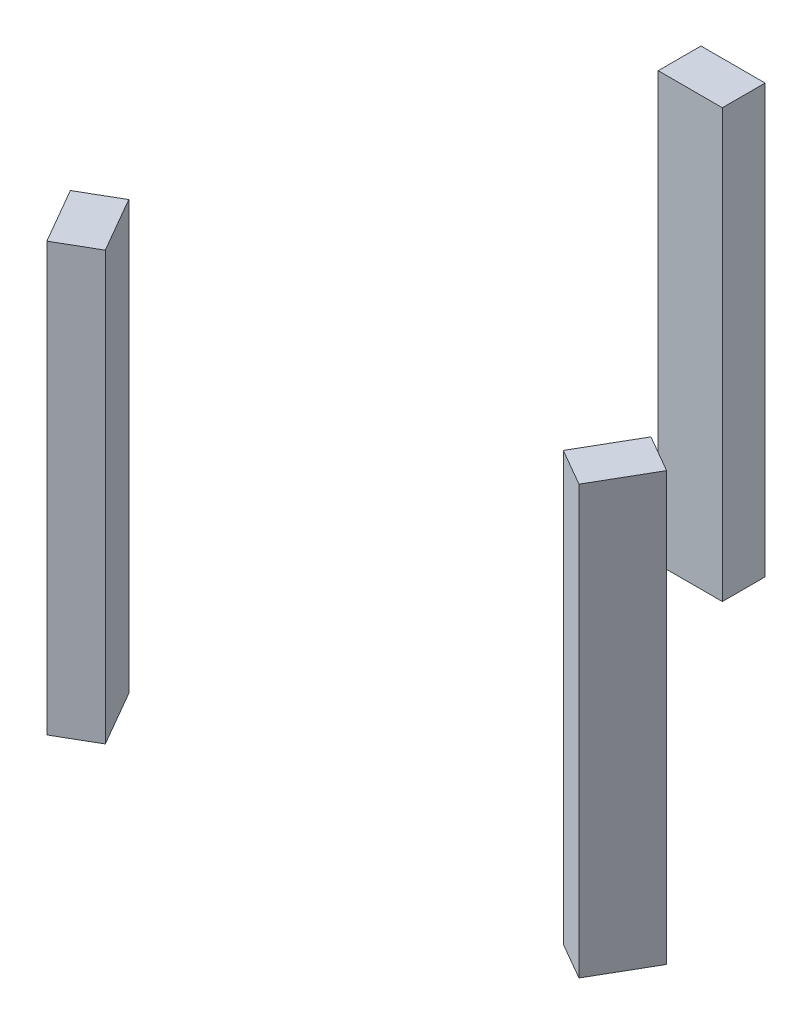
SolidWorks part; units mm, degrees
ref_plane "Alzado" through (0, 0, 0) normal (0, 0, 1) x (1, 0, 0)
ref_plane "Planta" through (0, 0, 0) normal (0, 1, 0) x (1, 0, 0)
ref_plane "Vista lateral" through (0, 0, 0) normal (1, 0, 0) x (0, 0, -1)
sketch "Croquis1" plane through (0, 0, 0) normal (0, -1, 0) x (1, 0, 0)
  line L0 (-118.923, 68.6603) -> (-103.923, 94.641)
  line L1 (0, 34.641) -> (-30, -17.3205) construction
  line L2 (-30, -17.3205) -> (30, -17.3205) construction
  line L3 (30, -17.3205) -> (0, 34.641) construction
  line L4 (-118.923, 68.6603) -> (-101.6025, 58.6603)
  line L5 (-101.6025, 58.6603) -> (-86.6025, 84.641)
  line L6 (-103.923, 94.641) -> (-86.6025, 84.641)
  line L7 (0, -137.3205) -> (-30, -137.3205)
  line L8 (0, -137.3205) -> (0, -117.3205)
  line L9 (0, -117.3205) -> (-30, -117.3205)
  line L10 (-30, -137.3205) -> (-30, -117.3205)
  line L11 (0, -137.3205) -> (-30, -117.3205) construction
  line L12 (0, -117.3205) -> (-30, -137.3205) construction
  line L13 (118.923, 68.6603) -> (133.923, 42.6795)
  line L14 (118.923, 68.6603) -> (101.6025, 58.6603)
  line L15 (101.6025, 58.6603) -> (116.6025, 32.6795)
  line L16 (133.923, 42.6795) -> (116.6025, 32.6795)
  circle A1 centre (0, 0) radius 17.3205 construction
  point P21 (0, 0)
  dimension "D1" = 3
  dimension "D2" = 60
  dimension "D3" = 20
  dimension "D4" = 100
  dimension "D5" = 30
extrude "Saliente-Extruir1" add sketch "Croquis1" against normal blind 200
